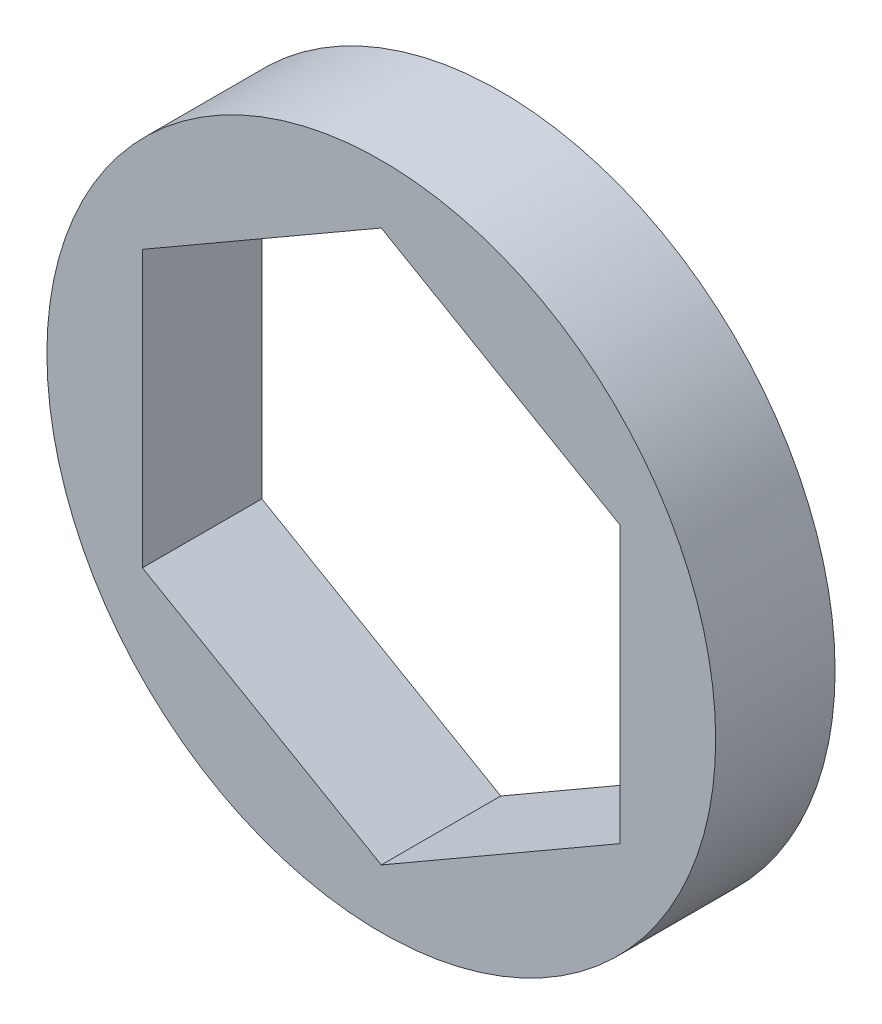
SolidWorks part; units mm, degrees
ref_plane "Front Plane" through (0, 0, 0) normal (0, 0, 1) x (1, 0, 0)
ref_plane "Top Plane" through (0, 0, 0) normal (0, 1, 0) x (1, 0, 0)
ref_plane "Right Plane" through (0, 0, 0) normal (1, 0, 0) x (0, 0, -1)
sketch "Sketch1" plane through (0, 0, 0) normal (0, 0, 1) x (1, 0, 0)
  line L1 (0, 7.3323) -> (-6.35, 3.6662)
  line L2 (-6.35, 3.6662) -> (-6.35, -3.6662)
  line L3 (-6.35, -3.6662) -> (0, -7.3323)
  line L4 (0, -7.3323) -> (6.35, -3.6662)
  line L5 (6.35, -3.6662) -> (6.35, 3.6662)
  line L6 (6.35, 3.6662) -> (0, 7.3323)
  circle A0 centre (0, 0) radius 6.35 construction
  circle A1 centre (0, 0) radius 8.89
  dimension "D2" = 17.78
  dimension "D1" = 12.7
extrude "Boss-Extrude1" add sketch "Sketch1" along normal blind 3.175
